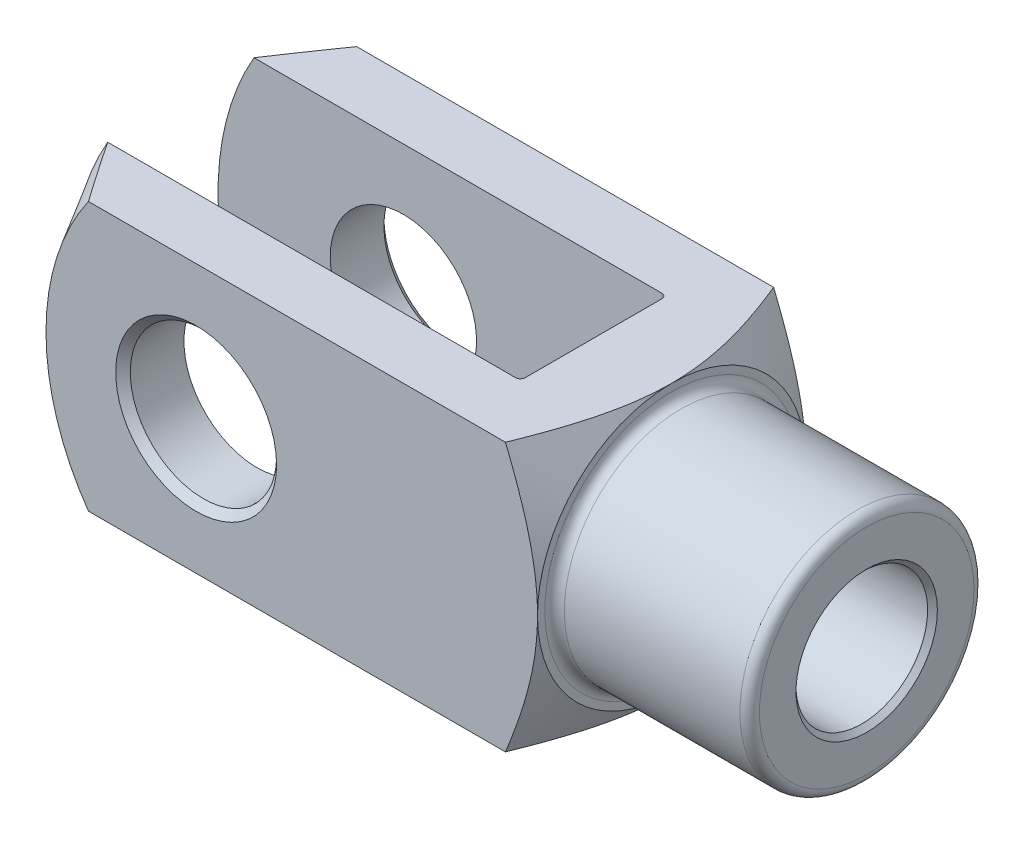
SolidWorks part; units mm, degrees
ref_plane "Front Plane" through (0, 0, 0) normal (0, 0, 1) x (1, 0, 0)
ref_plane "Top Plane" through (0, 0, 0) normal (0, 1, 0) x (1, 0, 0)
ref_plane "Right Plane" through (0, 0, 0) normal (1, 0, 0) x (0, 0, -1)
sketch "Sketch1" plane through (0, 0, 0) normal (1, 0, 0) x (0, 0, -1)
  line L0 (0, 0) -> (0, 50000) construction
  line L1 (0, 0) -> (50000, 0) construction
  line L2 (-27.5, -27.5) -> (-27.5, 27.5)
  line L3 (-27.5, 27.5) -> (27.5, 27.5)
  line L4 (27.5, -27.5) -> (27.5, 27.5)
  line L5 (-27.5, -27.5) -> (27.5, -27.5)
  point P9 (0, 27.5)
  point P11 (27.5, 0)
  point P12 (-27.5, 0)
  dimension "D1" = 55
  dimension "D2" = 55
extrude "Extrude1" add sketch "Sketch1" against normal blind 148
sketch "Sketch2" plane through (0, 0, 0) normal (1, 0, 0) x (0, 0, -1)
  circle A0 centre (0, 0) radius 24
  circle A1 centre (0, 0) radius 48
  dimension "D1" = 48
  dimension "D2" = 96
extrude "Extrude2" cut sketch "Sketch2" against normal blind 40
sketch "Sketch3" plane through (0, 0, 27.5) normal (0, 0, 1) x (1, 0, 0)
  circle A0 centre (-110, 0) radius 15
  dimension "D1" = 30
  dimension "D2" = 110
extrude "Extrude3" cut sketch "Sketch3" against normal through all
sketch "Sketch4" plane through (0, 27.5, 0) normal (0, 1, 0) x (1, 0, 0)
  line L0 (0, 0) -> (-50000, 0) construction
  line L1 (-148, -15) -> (-148, 15)
  line L2 (-148, 27.5) -> (-148, -27.5) construction
  line L3 (-148, 15) -> (-56, 15)
  line L4 (-56, 15) -> (-56, -15)
  line L5 (-110, 27.5) -> (-110, -27.5) construction
  line L6 (-148, -15) -> (-56, -15)
  point P7 (-110, 0)
  point P13 (-56, 0)
  point P14 (-148, 0)
  dimension "D1" = 54
  dimension "D2" = 30
extrude "Extrude4" cut sketch "Sketch4" against normal through all
fillet "Fillet1" radius 1 2 edges at (-56, 0, 15) (-56, 0, -15)
fillet "Fillet2" radius 2 2 edges at (0, 0, -24) (-40, 0, -24)
chamfer "Chamfer2" distance 1.5 angle 45 2 edges at (-95, 0, -27.5) (-95, 0, 27.5)
sketch "Sketch6" plane through (0, 0, 0) normal (0, 0, 1) x (1, 0, 0)
  line L0 (-40, -27.5) -> (-40, -55)
  line L1 (-40, -55) -> (-55.8771, -55)
  line L2 (-55.8771, -55) -> (-40, -27.5)
  dimension "D1" = 30
  dimension "D2" = 55
revolve "Cut-Revolve1" cut sketch "Sketch6" angle 360 about axis through (-40, 0, 0) along (1, 0, 0)
sketch "Sketch7" plane through (0, 0, 0) normal (0, 1, 0) x (1, 0, 0)
  line L0 (-140.7831, -27.5) -> (-148, -15)
  line L1 (-148, 15) -> (-140.7831, 27.5)
  line L2 (-140.7831, 27.5) -> (-203, 27.5)
  line L3 (-148, 15) -> (-148, -15)
  line L4 (-203, 27.5) -> (-203, -27.5)
  line L5 (-203, -27.5) -> (-140.7831, -27.5)
  line L6 (-148, 27.5) -> (-46.5765, 27.5) construction
  line L7 (-148, -27.5) -> (-46.5765, -27.5) construction
  line L8 (-93, 0.6162) -> (-93, 50000.6162) construction
  dimension "D1" = 120
  dimension "D2" = 55
  dimension "D3" = 55
revolve "Cut-Revolve2" cut sketch "Sketch7" angle 180 about L8
sketch "Sketch8" plane through (0, 0, 0) normal (1, 0, 0) x (0, 0, -1)
  circle A0 centre (0, 0) radius 13.5
  dimension "D1" = 27
extrude "Extrude5" cut sketch "Sketch8" against normal through all
chamfer "Chamfer3" distance 1 angle 45 1 edges at (0, 0, -13.5)
equation "\"D2@Sketch1\" = \"D1@Sketch1\""
equation "\"D2@Sketch2\" = \"D1@Sketch2\"*2"
equation "\"D2@Sketch6\" = \"D1@Sketch1\""
equation "\"D2@Sketch7\" = \"D1@Sketch1\""
equation "\"D3@Sketch7\" = \"D1@Sketch1\""
